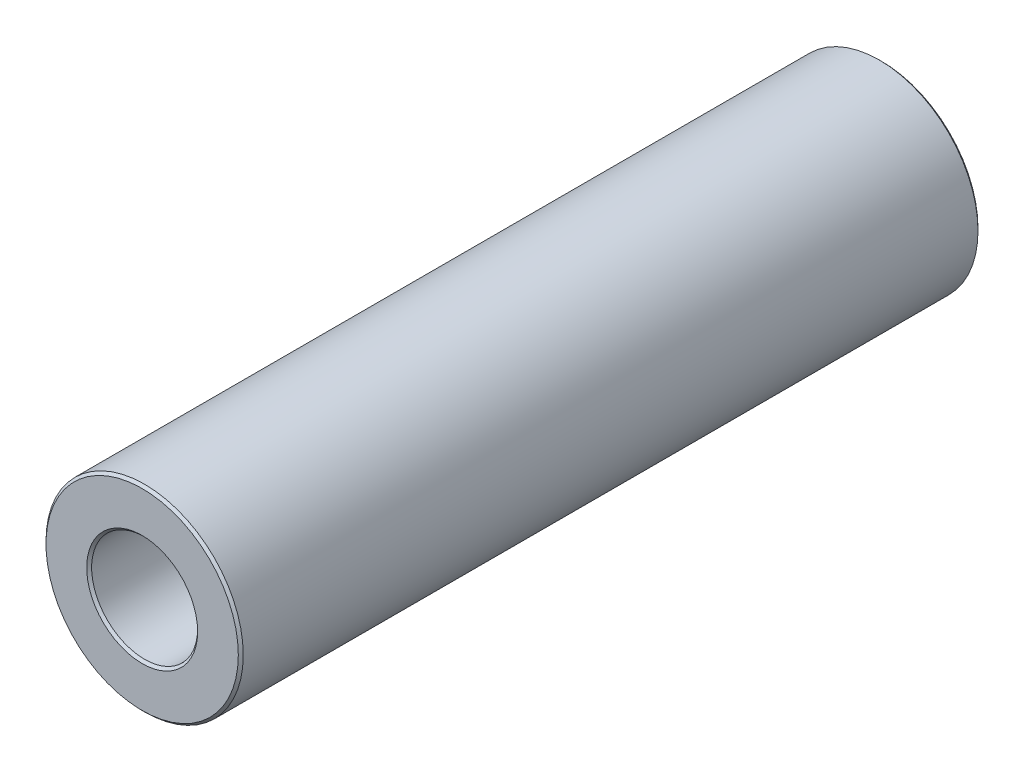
SolidWorks part; units mm, degrees
ref_plane "Front Plane" through (0, 0, 0) normal (0, 0, 1) x (1, 0, 0)
ref_plane "Top Plane" through (0, 0, 0) normal (0, 1, 0) x (1, 0, 0)
ref_plane "Right Plane" through (0, 0, 0) normal (1, 0, 0) x (0, 0, -1)
sketch "Sketch1" plane through (0, 0, 0) normal (0, 0, 1) x (1, 0, 0)
  circle A0 centre (0, 0) radius 4
  circle A1 centre (0, 0) radius 2.15
  dimension "D1" = 8
  dimension "D2" = 4.3
extrude "Boss-Extrude2" add sketch "Sketch1" along normal mid plane 30
chamfer "Chamfer3" distance 0.1 angle 45 4 edges at (4, 0, 15) (4, 0, -15) (2.15, 0, -15) (2.15, 0, 15)
